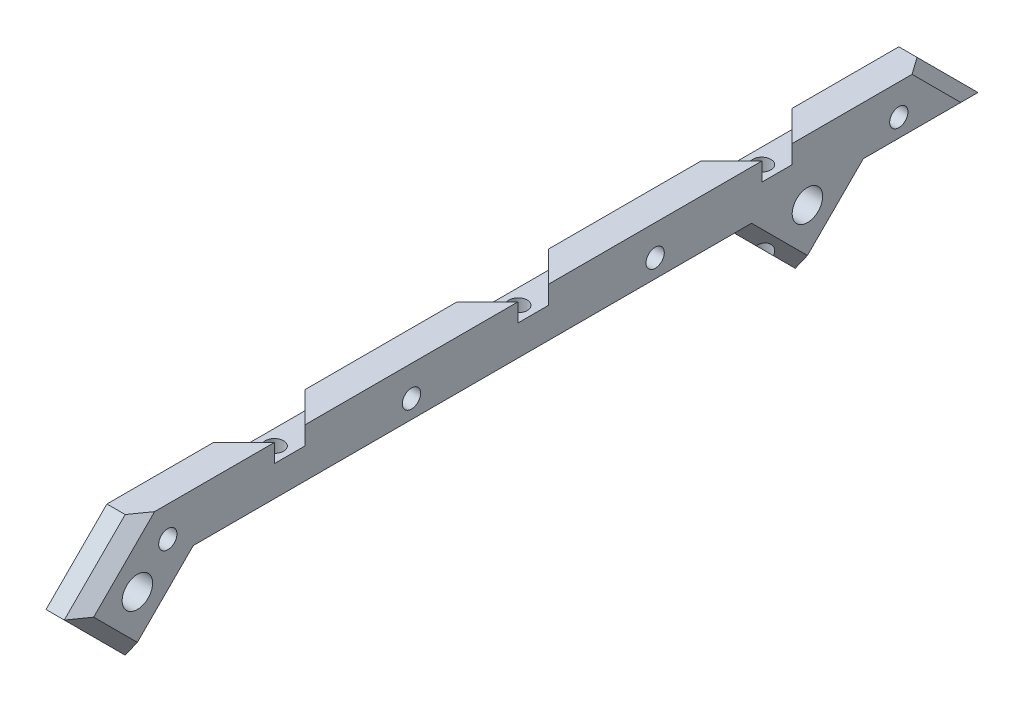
SolidWorks part; units mm, degrees
ref_plane "Alzado" through (0, 0, 0) normal (0, 0, 1) x (1, 0, 0)
ref_plane "Planta" through (0, 0, 0) normal (0, 1, 0) x (1, 0, 0)
ref_plane "Vista lateral" through (0, 0, 0) normal (1, 0, 0) x (0, 0, -1)
sketch "Croquis1" plane through (0, 0, 0) normal (1, 0, 0) x (0, 0, -1)
  line L0 (0, 0) -> (0, 50000) construction
  line L1 (0, 0) -> (50000, 0) construction
  line L2 (-75, 0) -> (-65, 10)
  line L3 (-65, 10) -> (65, 10)
  line L6 (45, -10) -> (35, 0)
  line L7 (35, 0) -> (-55, 0)
  line L8 (0, 10) -> (0, 0) construction
  line L9 (45, -10) -> (55, 0)
  line L10 (-75, 10) -> (75, 10) construction
  line L11 (-75, 10) -> (-75, -10) construction
  line L12 (-75, -10) -> (75, -10) construction
  line L13 (75, 10) -> (75, -10) construction
  line L14 (55, 0) -> (75, 0)
  line L15 (75, 0) -> (65, 10)
  line L16 (-75, 0) -> (-65, -10)
  line L17 (-65, -10) -> (-55, 0)
  line L18 (-65, 0) -> (-65, -10) construction
  line L19 (45, 0) -> (45, -10) construction
  circle A0 centre (-65, 0) radius 2.5
  circle A1 centre (45, 0) radius 2.5
  point P18 (-75, 0)
  dimension "D7" = 5
  dimension "D1" = 45
  dimension "D2" = 150
  dimension "D3" = 20
  dimension "D4" = 10
  dimension "D5" = 20
  dimension "D6" = 20
extrude "Saliente-Extruir1" add sketch "Croquis1" along normal blind 5 contours L16 L17 L7 L6 L9 L14 L15 L3 L2 A1 A0
chamfer "Chaflán1" distance 2 angle 45 9 edges at (5, -5, -40) (5, -5, -50) (5, 0, -65) (5, 5, -70) (5, 10, 0) (5, 0, 10) (5, -5, 60) (5, -5, 70) (5, 5, 70)
sketch "Croquis2" plane through (5, 0, 0) normal (1, 0, 0) x (0, 0, -1)
  line L2 (-70, 5) -> (70, 5) construction
  line L3 (-75, 0) -> (-65, 10) construction
  line L4 (65, 10) -> (75, 0) construction
  line L5 (-70, -5) -> (-60, 5) construction
  line L6 (-65, -10) -> (-75, 0) construction
  circle A0 centre (-65, 0) radius 2.5 construction
  circle A1 centre (-65, 0) radius 2.5 construction
  circle A2 centre (-60, 5) radius 1.5
  circle A3 centre (-20, 5) radius 1.5
  circle A4 centre (20, 5) radius 1.5
  circle A5 centre (60, 5) radius 1.5
  dimension "D4" = 3
  dimension "D1" = 40
  dimension "D2" = 40
  dimension "D3" = 40
extrude "Cortar-Extruir1" cut sketch "Croquis2" against normal through all
sketch "Croquis3" plane through (0, 10, 0) normal (0, 1, 0) x (1, 0, 0)
  line L0 (0, 0) -> (5, 0) construction
  line L1 (5, -62.1716) -> (5, 62.1716) construction
  line L2 (0, -7.5) -> (5, -2.5)
  line L3 (0, -65) -> (0, 65) construction
  line L4 (5, -2.5) -> (5, 2.5)
  line L5 (5, 2.5) -> (0, 7.5)
  line L6 (0, 7.5) -> (0, -7.5)
  line L7 (5, 42.5) -> (0, 47.5)
  line L8 (0, 32.5) -> (5, 37.5)
  line L9 (5, 37.5) -> (5, 42.5)
  line L10 (0, 47.5) -> (0, 32.5)
  line L11 (0, -32.5) -> (0, -47.5)
  line L12 (0, -47.5) -> (5, -42.5)
  line L13 (5, -42.5) -> (5, -37.5)
  line L14 (5, -37.5) -> (0, -32.5)
  circle A0 centre (2.5, 0) radius 1.5 construction
  point P11 (5, 0)
  dimension "D1" = 3
  dimension "D2" = 15
  dimension "D3" = 45
  dimension "D5" = 35
  dimension "D7" = 35
  dimension "D4" = 2
  dimension "D6" = 2
extrude "Cortar-Extruir2" cut sketch "Croquis3" against normal blind 3 contours L5 L2 M5 M8 | L14 L12 M5 M8 | L8 L9 L7 L10
sketch "Croquis4" plane through (0, 7, 0) normal (0, 1, 0) x (1, 0, 0)
  line L0 (5, -40) -> (0, -40) construction
  line L1 (5, -42.5) -> (5, -37.5) construction
  line L2 (0, -32.5) -> (0, -47.5) construction
  circle A0 centre (2.5, -40) radius 1.5
  circle A1 centre (2.5, 0) radius 1.5
  circle A2 centre (2.5, 40) radius 1.5
  dimension "D1" = 3
  dimension "D3" = 40
  dimension "D2" = 3
extrude "Cortar-Extruir3" cut sketch "Croquis4" against normal through all
